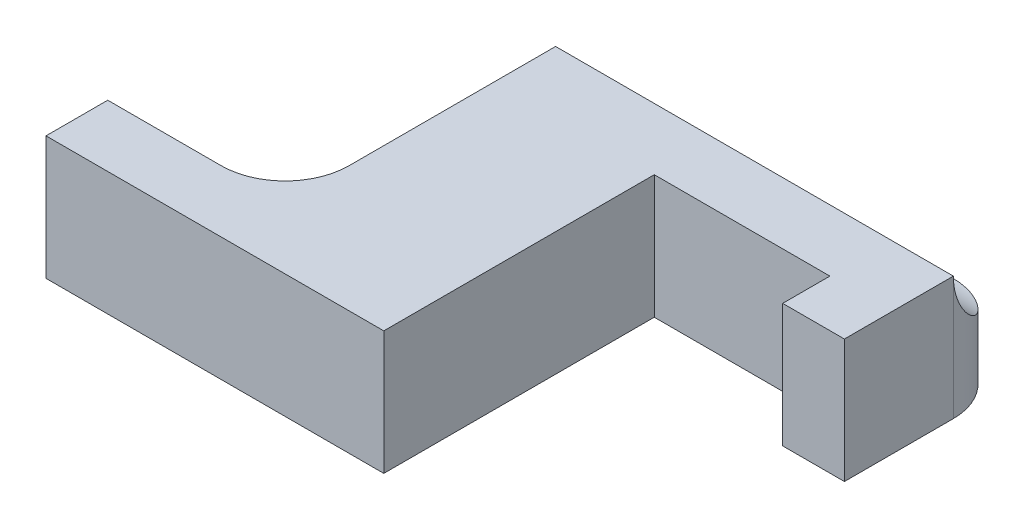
SolidWorks part; units mm, degrees
other "<Connecting Part 3>-<Cut-Extrude1>"
ref_plane "Front Plane" through (0, 0, 0) normal (0, 0, 1) x (1, 0, 0)
ref_plane "Top Plane" through (0, 0, 0) normal (0, 1, 0) x (1, 0, 0)
ref_plane "Right Plane" through (0, 0, 0) normal (1, 0, 0) x (0, 0, -1)
mirrored part "Connecting Part 3_Mirrored"
